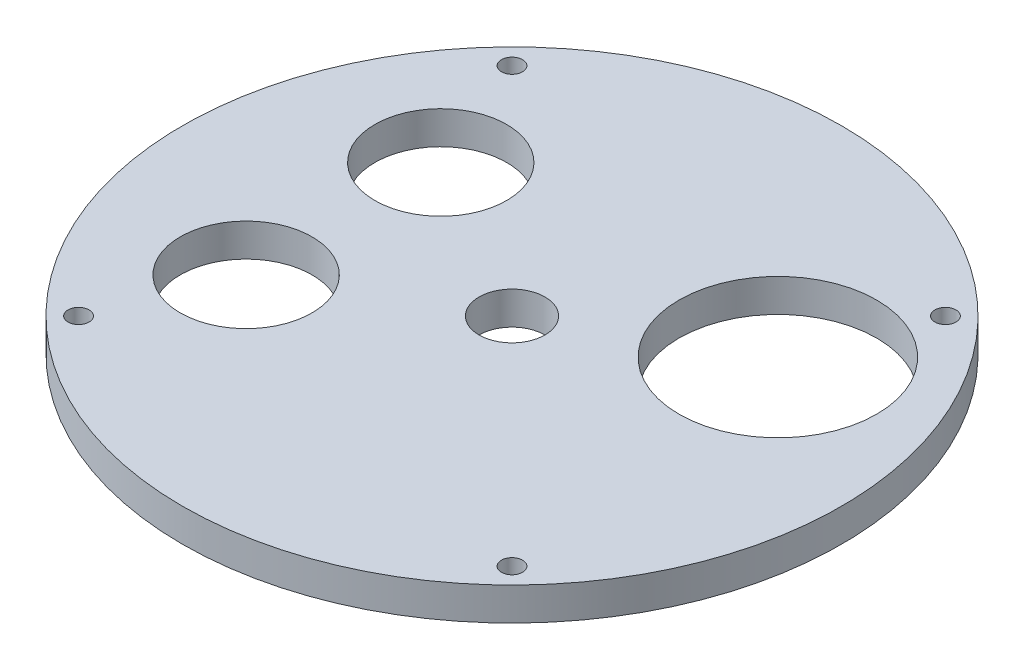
SolidWorks part; units mm, degrees
ref_plane "Front Plane" through (0, 0, 0) normal (0, 0, 1) x (1, 0, 0)
ref_plane "Top Plane" through (0, 0, 0) normal (0, 1, 0) x (1, 0, 0)
ref_plane "Right Plane" through (0, 0, 0) normal (1, 0, 0) x (0, 0, -1)
sketch "Sketch1" plane through (0, 0, 0) normal (0, 1, 0) x (1, 0, 0)
  circle A0 centre (0, 0) radius 63.5
  dimension "D1" = 127
extrude "Boss-Extrude1" add sketch "Sketch1" along normal blind 6.35
sketch "Sketch2" plane through (0, 6.35, 0) normal (0, 1, 0) x (1, 0, 0)
  line L0 (-31.75, 0) -> (31.75, 0)
  line L1 (31.75, -54.9926) -> (-31.75, -54.9926)
  line L2 (31.75, -54.9926) -> (31.75, 54.9926)
  line L3 (31.75, 54.9926) -> (-31.75, 54.9926)
  line L4 (-31.75, -54.9926) -> (-31.75, 54.9926)
  line L5 (31.75, -54.9926) -> (-31.75, 54.9926) construction
  line L6 (31.75, 54.9926) -> (-31.75, -54.9926) construction
  line L7 (31.75, 0) -> (45.1208, 0)
  line L8 (41.7582, 41.7582) -> (0, 0)
  line L9 (0, 0) -> (-41.7582, 41.7582)
  line L10 (0, 68.58) -> (0, -68.58)
  line L11 (-31.75, 0) -> (-45.1208, 0)
  line L12 (41.7582, -41.7582) -> (0, 0)
  line L13 (0, 0) -> (-41.7582, -41.7582)
  circle A0 centre (-32.476, 18.75) radius 12.7
  circle A2 centre (32.476, 18.75) radius 19.05
  circle A5 centre (-32.476, -18.75) radius 12.7
  circle A7 centre (19.5, -48.5) radius 1.65
  circle A8 centre (-19.5, -48.5) radius 1.65
  circle A9 centre (0, 0) radius 1.9197
  circle A10 centre (0, 0) radius 63.5 construction
  circle A11 centre (0, 0) radius 68.58
  circle A12 centre (41.7582, -41.7582) radius 2.032
  circle A13 centre (41.7582, 41.7582) radius 2.032
  circle A14 centre (-41.7582, 41.7582) radius 2.032
  circle A15 centre (-41.7582, -41.7582) radius 2.032
  circle A16 centre (0, -16) radius 2.5
  circle A17 centre (0, 16) radius 2.5
  circle A18 centre (0, 0) radius 59.055
  circle A19 centre (0, 0) radius 37.5
  dimension "D2" = 90
  dimension "D4" = 38.1
  dimension "D5" = 25.4
  dimension "D6" = 25.4
  dimension "D7" = 118.11
  dimension "D8" = 4.064
  dimension "D9" = 4.064
  dimension "D10" = 137.16
  dimension "D1" = 63.5
  dimension "D11" = 90
extrude "Cut-Extrude1" cut sketch "Sketch2" against normal through all contours A13 A18 L8 | A18 A13 | L8 A18 A13 | L9 A18 A14 | A14 A18 L9 | L13 A18 A15 | A15 A18 L13 | A18 A15 | A18 A12 | L12 A18 A12 | A12 A18 L12 | L2 A2 | L2 A2 L8 | L8 A2 | L4 A0 | L4 A0 | L4 A5 | L4 A5 | A19 L8 L2 A2 | A19 L2 L8 | A2 A19 L2 L7 | L8 A2 L2 | A5 A19 L4 | A19 L4 A5 L13 | A19 L13 A5 | L13 A19 A5 | L4 A19 A0 | A19 L9 A0 L4 | A0 A19 L9 | L2 A2 L7 | L0 A2 L2 | A9
sketch "Sketch3" plane through (0, 6.35, 0) normal (0, 1, 0) x (1, 0, 0)
  circle A0 centre (0, 0) radius 6.35
extrude "Cut-Extrude2" cut sketch "Sketch3" against normal through all
chamfer "Chamfer3" [suppressed] distance 1.5875 angle 45
chamfer "Chamfer5" [suppressed] distance 1.5875 angle 45
sketch "Sketch4" plane through (0, 0, 0) normal (0, -1, 0) x (1, 0, 0)
  line L0 (41.7582, 41.7582) -> (43.195, 43.195)
  line L1 (43.195, 43.195) -> (44.9013, 44.9013)
  circle A0 centre (41.7582, 41.7582) radius 2.032 construction
  circle A1 centre (0, 0) radius 63.5 construction
